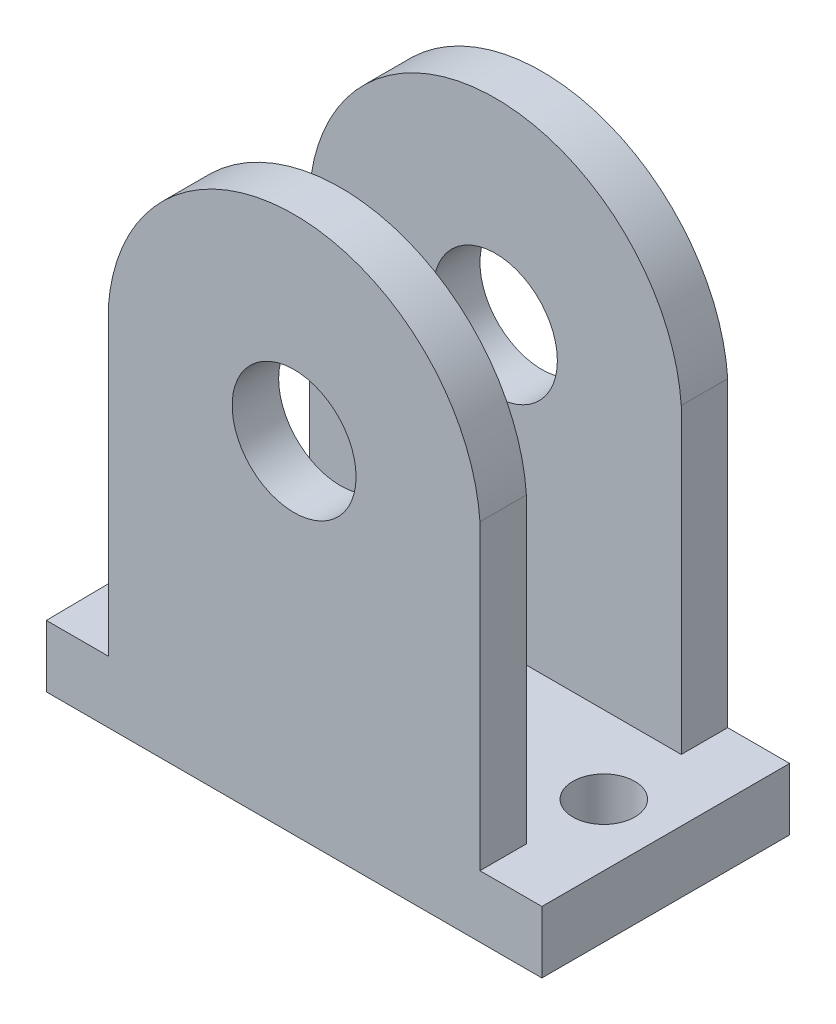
SolidWorks part; units mm, degrees
ref_plane "Front Plane" through (0, 0, 0) normal (0, 0, 1) x (1, 0, 0)
ref_plane "Top Plane" through (0, 0, 0) normal (0, 1, 0) x (1, 0, 0)
ref_plane "Right Plane" through (0, 0, 0) normal (1, 0, 0) x (0, 0, -1)
sketch "Sketch2" plane through (0, 0, 0) normal (0, 0, 1) x (1, 0, 0)
  line L0 (-31.1739, 16.5278) -> (6.9261, 16.5278)
  line L1 (6.9261, 16.5278) -> (6.9261, 89.8896) construction
  line L2 (6.9261, 89.8896) -> (-31.1739, 89.8896) construction
  line L3 (-31.1739, 89.8896) -> (-31.1739, 16.5278) construction
  line L4 (-31.1739, 16.5278) -> (-31.1739, 47.5097)
  line L5 (6.9261, 47.5097) -> (6.9261, 16.5278)
  line L6 (-12.1239, 16.5278) -> (-12.1239, 65.2716) construction
  line L7 (-31.1739, 47.5097) -> (6.9261, 47.5097) construction
  arc A0 (-31.1739, 47.5097) -> (6.9261, 47.5097) centre (-12.1239, 46.1749) cw
extrude "Boss-Extrude2" add sketch "Sketch2" along normal blind 25.4
sketch "Sketch3" plane through (0, 0, 0) normal (0, 1, 0) x (1, 0, 0)
  line L0 (-31.1739, -12.7) -> (6.9261, -12.7) construction
  line L1 (-31.1739, -25.4) -> (-31.1739, 0) construction
  line L2 (6.9261, -25.4) -> (6.9261, 0) construction
  line L3 (-31.1739, -12.7) -> (-31.1739, -4.7625)
  line L4 (-31.1739, -4.7625) -> (6.9261, -4.7625)
  line L5 (6.9261, -4.7625) -> (6.9261, -20.6375)
  line L6 (6.9261, -20.6375) -> (-31.1739, -20.6375)
  line L7 (-31.1739, -20.6375) -> (-31.1739, -12.7)
extrude "Cut-Extrude1" cut sketch "Sketch3" along normal blind 82.55
ref_plane "Plane1" through (0, 16.5278, 0) normal (0, -1, 0) x (1, 0, 0)
sketch "Sketch6" plane through (0, 16.5278, 0) normal (0, -1, 0) x (1, 0, 0)
  line L0 (-37.5239, 25.4) -> (-37.8128, 0)
  line L1 (-37.5239, 25.4) -> (13.2761, 25.4)
  line L2 (-37.8128, 0) -> (-31.1739, 0)
  line L3 (-31.1739, 0) -> (6.9261, 0)
  line L4 (6.9261, 0) -> (13.2761, 0)
  line L5 (13.2761, 0) -> (13.2761, 25.4)
extrude "Boss-Extrude4" add sketch "Sketch6" along normal blind 6.35
sketch "Sketch7" plane through (0, 0, 25.4) normal (0, 0, 1) x (1, 0, 0)
  circle A0 centre (-12.1239, 45.1437) radius 6.35
extrude "Cut-Extrude3" cut sketch "Sketch7" against normal blind 40.894
sketch "Sketch8" plane through (0, 16.5278, 0) normal (0, -1, 0) x (1, 0, 0)
  circle A0 centre (-31.3184, 12.7) radius 3.175
  circle A1 centre (6.9261, 12.7) radius 3.175
extrude "Cut-Extrude4" cut sketch "Sketch8" along normal blind 10.16
